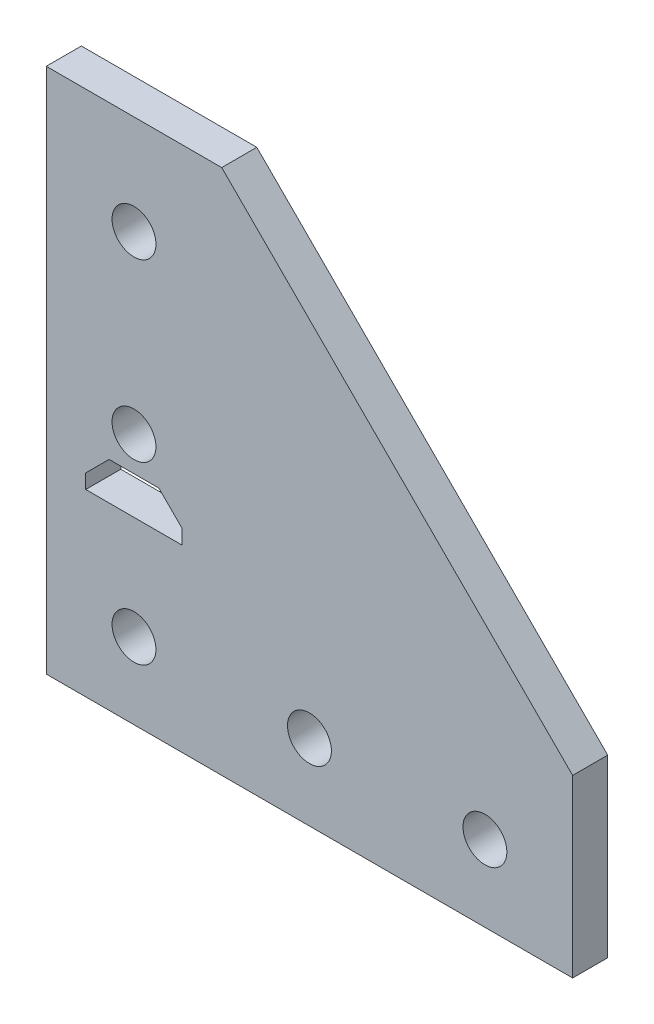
SolidWorks part; units mm, degrees
ref_plane "Front Plane" through (0, 0, 0) normal (0, 0, 1) x (1, 0, 0)
ref_plane "Top Plane" through (0, 0, 0) normal (0, 1, 0) x (1, 0, 0)
ref_plane "Right Plane" through (0, 0, 0) normal (1, 0, 0) x (0, 0, -1)
imported_body "Imported1"
sketch "Sketch2" plane through (0, 0, 0) normal (0, 0, -1) x (-1, 0, 0)
  line L0 (-15.4993, 22.1125) -> (-12.84, 24.7719) construction
  line L1 (-12.84, 24.7719) -> (-7.16, 24.7719) construction
  line L2 (-7.16, 24.7719) -> (-4.5007, 22.1125) construction
  line L3 (-4.5007, 22.1125) -> (-4.5007, 20.4725) construction
  line L4 (-4.5007, 20.4725) -> (-7.16, 20.4725) construction
  line L5 (0, 0) -> (0, 60)
  line L6 (0, 60) -> (-20, 60)
  line L7 (-20, 60) -> (-60, 20)
  line L8 (-60, 20) -> (-60, 0)
  line L9 (-60, 0) -> (0, 0)
  line L10 (0, 0) -> (0, 60)
  line L11 (0, 60) -> (-20, 60)
  line L12 (-20, 60) -> (-60, 20)
  line L13 (-60, 20) -> (-60, 0)
  line L14 (-60, 0) -> (0, 0)
  line L15 (-12.84, 20.4725) -> (-15.4993, 20.4725) construction
  line L16 (-15.4993, 20.4725) -> (-15.4993, 22.1125) construction
  line L17 (-15.4993, 22.1125) -> (-12.84, 24.7719)
  line L18 (-12.84, 24.7719) -> (-7.16, 24.7719)
  line L19 (-7.16, 24.7719) -> (-4.5007, 22.1125)
  line L20 (-4.5007, 22.1125) -> (-4.5007, 20.4725)
  line L21 (-4.5007, 20.4725) -> (-7.16, 20.4725)
  line L22 (-12.84, 20.4725) -> (-15.4993, 20.4725)
  line L23 (-15.4993, 20.4725) -> (-15.4993, 22.1125)
  line L24 (-12.84, 20.4725) -> (-7.16, 20.4725)
  dimension "D1" = 0
extrude "Cut-Extrude1" cut sketch "Sketch2" against normal through all flip side to cut
